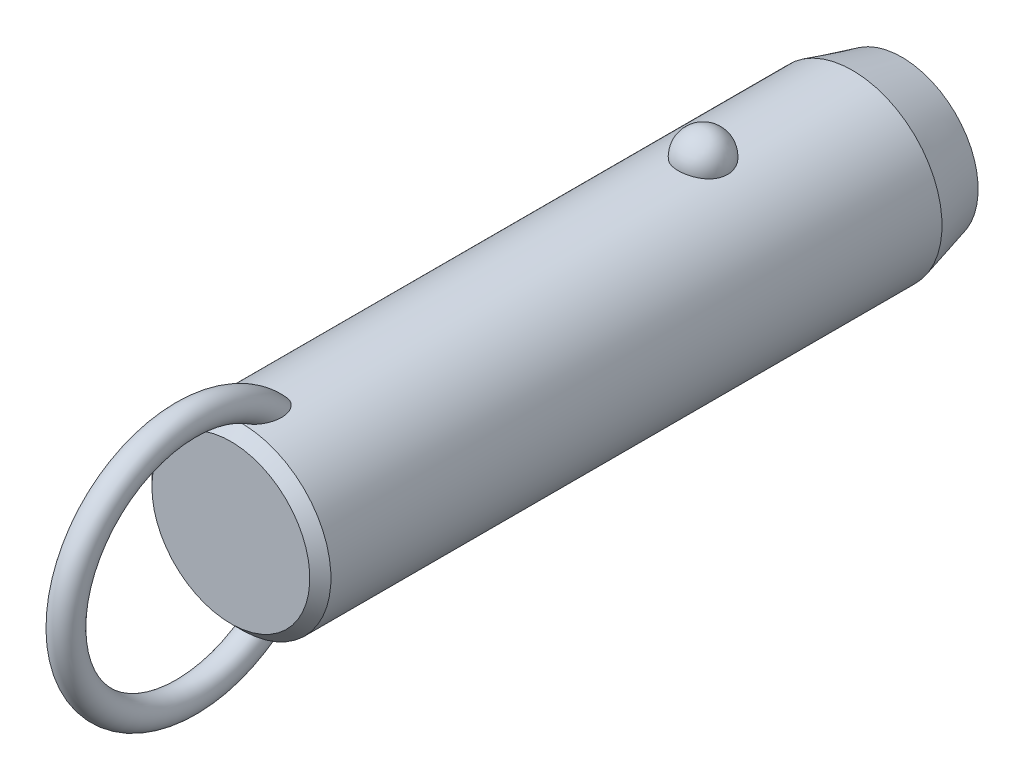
SolidWorks part; units mm, degrees
ref_plane "Front Plane" through (0, 0, 0) normal (0, 0, 1) x (1, 0, 0)
ref_plane "Top Plane" through (0, 0, 0) normal (0, 1, 0) x (1, 0, 0)
ref_plane "Right Plane" through (0, 0, 0) normal (1, 0, 0) x (0, 0, -1)
sketch "Sketch2" plane through (0, 0, 0) normal (0, 0, 1) x (1, 0, 0)
  circle A0 centre (0, 0) radius 12.7
  point P3 (0, 12.7)
  dimension "D1" = 25.4
extrude "Boss-Extrude1" add sketch "Sketch2" along normal blind 50.8
sketch "Sketch3" plane through (0, 0, 0) normal (0, 0, -1) x (-1, 0, 0)
  circle A0 centre (0, 0) radius 12.7
  dimension "D1" = 25.4
extrude "Boss-Extrude2" add sketch "Sketch3" along normal blind 31.7
chamfer "Chamfer1" distance 7 angle 15 1 edges at (-12.7, 0, -31.7)
sketch "Sketch12" plane through (0, 0, 0) normal (1, 0, 0) x (0, 0, -1)
  line L0 (-50.8, 12.7) -> (-50.8, -12.7) construction
  point P0 (-50.8, 0)
sketch "Sketch13" plane through (0, 0, 0) normal (1, 0, 0) x (0, 0, -1)
  circle A0 centre (-69.85, 0) radius 19.05
  point P2 (-50.8, 0)
  dimension "D1" = 38.1
sketch "Sketch14" plane through (0, 0, 0) normal (0, 1, 0) x (1, 0, 0)
  circle A0 centre (0, -52.8) radius 2
  point P2 (0, -50.8)
  dimension "D1" = 4
sweep "Sweep1" add profiles "Sketch14" path "Sketch13"
sketch "Sketch15" plane through (0, 0, 50.8) normal (0, 0, 1) x (1, 0, 0)
  circle A0 centre (0, 0) radius 12.7
  dimension "D1" = 25.4
extrude "Boss-Extrude3" add sketch "Sketch15" along normal blind 12.7
chamfer "Chamfer2" distance 1.5 angle 45 1 edges at (12.7, 0, 63.5)
sketch "Sketch18" plane through (0, 0, 0) normal (1, 0, 0) x (0, 0, -1)
  line L0 (24.7, 12.7) -> (-55.651, 12.7) construction
  line L1 (3.5, 16.2) -> (3.5, 9.2)
  line L2 (-55.651, -12.7) -> (24.7, -12.7) construction
  arc A0 (3.5, 16.2) -> (3.5, 9.2) centre (3.5, 12.7) ccw
  point P4 (0, 12.7)
  dimension "D1" = 28.9
revolve "Revolve1" add sketch "Sketch18" angle 360 about L1
